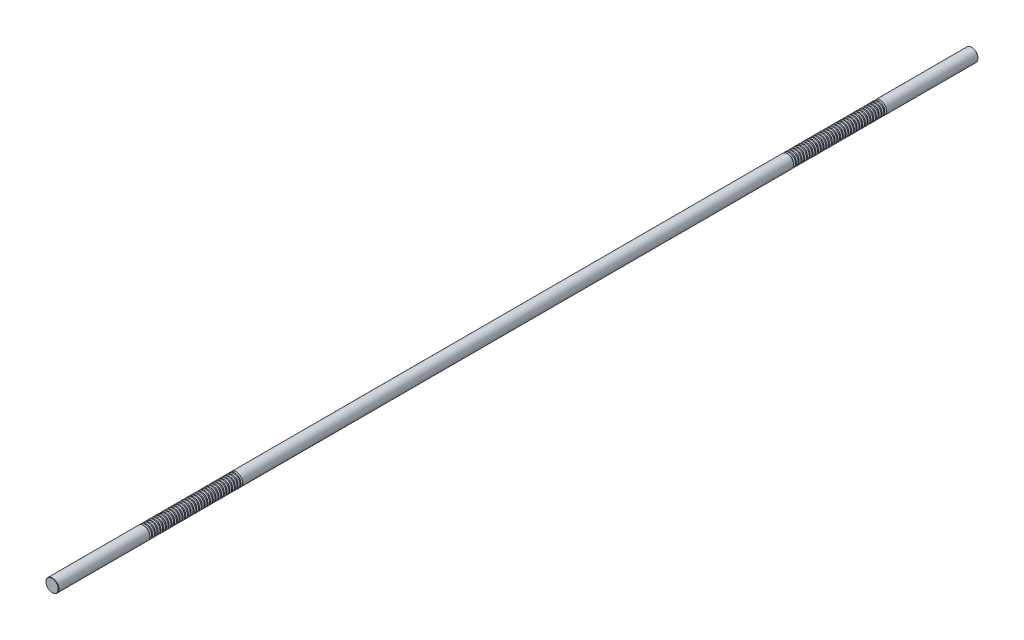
SolidWorks part; units mm, degrees
ref_plane "Front Plane" through (0, 0, 0) normal (0, 0, 1) x (1, 0, 0)
ref_plane "Top Plane" through (0, 0, 0) normal (0, 1, 0) x (1, 0, 0)
ref_plane "Right Plane" through (0, 0, 0) normal (1, 0, 0) x (0, 0, -1)
sketch "Sketch1" plane through (0, 0, 0) normal (0, 0, 1) x (1, 0, 0)
  circle A0 centre (0, 0) radius 7
  dimension "D1" = 14
extrude "Boss-Extrude1" add sketch "Sketch1" along normal mid plane 1000
chamfer "Chamfer1" distance 0.35 angle 45 2 edges at (7, 0, -500) (7, 0, 500)
sketch "Sketch2" plane through (0, 0, 0) normal (1, 0, 0) x (0, 0, -1)
  line L0 (400.2345, 7) -> (398.2655, 7)
  line L1 (499.65, 7) -> (-499.65, 7) construction
  line L2 (398.2655, 7) -> (398.7345, 5.25)
  line L3 (398.7345, 5.25) -> (399.7655, 5.25)
  line L4 (399.7655, 5.25) -> (400.2345, 7)
  line L5 (500, -6.65) -> (500, 6.65) construction
  point P4 (399.25, 7)
  point P7 (399.25, 5.25)
  point P8 (400, 6.125)
  point P9 (398.5, 6.125)
  dimension "D1" = 1.5
  dimension "D2" = 100
  dimension "D3" = 1.75
  dimension "D4" = 30
revolve "Cut-Revolve1" cut sketch "Sketch2" angle 360 about axis through (0, 0, 500) along (0, 0, -1)
pattern_linear "LPattern1" count 34 spacing 3 along (0, 0, 1) of "Cut-Revolve1"
pattern_linear "LPattern2" count 2 spacing 700 along (0, 0, 1) of "Cut-Revolve1", "LPattern1"
